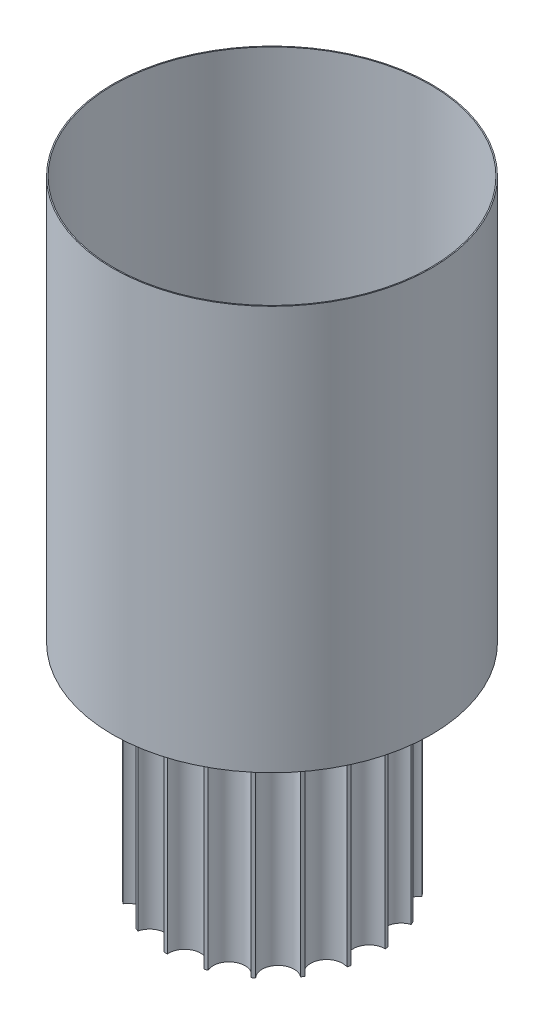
SolidWorks part; units mm, degrees
ref_plane "Alzado" through (0, 0, 0) normal (0, 0, 1) x (1, 0, 0)
ref_plane "Planta" through (0, 0, 0) normal (0, 1, 0) x (1, 0, 0)
ref_plane "Vista lateral" through (0, 0, 0) normal (1, 0, 0) x (0, 0, -1)
sketch "Croquis1" plane through (0, 0, 0) normal (0, 1, 0) x (1, 0, 0)
  circle A0 centre (0, 0) radius 100
  dimension "D1" = 200
extrude "Saliente-Extruir1" add sketch "Croquis1" along normal blind 200
sketch "Croquis2" plane through (0, 200, 0) normal (0, 1, 0) x (1, 0, 0)
  line L0 (0, 0) -> (0, 100) construction
  circle A0 centre (0, 0) radius 100 construction
  circle A1 centre (0, 100) radius 15
  circle A2 centre (32.4699, 94.5817) radius 15
  circle A3 centre (61.4213, 78.9141) radius 15
  circle A4 centre (83.7166, 54.6948) radius 15
  circle A5 centre (96.94, 24.5485) radius 15
  circle A6 centre (99.6584, -8.2579) radius 15
  circle A7 centre (91.5773, -40.1695) radius 15
  circle A8 centre (73.5724, -67.7282) radius 15
  circle A9 centre (47.5947, -87.9474) radius 15
  circle A10 centre (16.4595, -98.6361) radius 15
  circle A11 centre (-16.4595, -98.6361) radius 15
  circle A12 centre (-47.5947, -87.9474) radius 15
  circle A13 centre (-73.5724, -67.7282) radius 15
  circle A14 centre (-91.5773, -40.1695) radius 15
  circle A15 centre (-99.6584, -8.2579) radius 15
  circle A16 centre (-96.94, 24.5485) radius 15
  circle A17 centre (-83.7166, 54.6948) radius 15
  circle A18 centre (-61.4213, 78.9141) radius 15
  circle A19 centre (-32.4699, 94.5817) radius 15
  point P8 (-17.9574, 98.3745)
  point P9 (-14.9578, 98.875)
  point P45 (0, 0)
  dimension "D1" = 30
  dimension "D2" = 19
extrude "Cortar-Extruir1" cut sketch "Croquis2" against normal blind 200
sketch "Croquis5" plane through (0, 200, 0) normal (0, 1, 0) x (1, 0, 0)
  circle A0 centre (0, 0) radius 75
  dimension "D1" = 150
extrude "Cortar-Extruir2" cut sketch "Croquis5" against normal blind 180
sketch "Croquis6" plane through (0, 20, 0) normal (0, 1, 0) x (1, 0, 0)
  circle A0 centre (0, 0) radius 5
  dimension "D1" = 10
extrude "Cortar-Extruir3" cut sketch "Croquis6" against normal blind 180
fillet "Redondeo1" radius 2 1 edges at (0, 200, 75)
sketch "Croquis3" plane through (0, 0, 0) normal (0, -1, 0) x (1, 0, 0)
  circle A0 centre (0, 0) radius 80
  dimension "D1" = 160
extrude "Saliente-Extruir2" add sketch "Croquis3" along normal blind 3 separate body
sketch "Croquis4" plane through (0, 200, 0) normal (0, 1, 0) x (1, 0, 0)
  circle A0 centre (0, 0) radius 100
  dimension "D1" = 200
extrude "Saliente-Extruir3" add sketch "Croquis4" along normal blind 3 separate body
sketch "Croquis7" plane through (0, 203, 0) normal (0, 1, 0) x (1, 0, 0)
  circle A0 centre (0, 0) radius 10
  dimension "D1" = 20
extrude "Saliente-Extruir4" add sketch "Croquis7" along normal blind 0.01
sketch "Croquis8" plane through (0, 203.01, 0) normal (0, 1, 0) x (1, 0, 0)
  circle A0 centre (0, 0) radius 150
  circle A1 centre (0, 0) radius 149
  dimension "D1" = 300
  dimension "D2" = 298
extrude "Saliente-Extruir5" add sketch "Croquis8" along normal blind 380 separate body
sketch "Croquis9" plane through (0, -3, 0) normal (0, -1, 0) x (1, 0, 0)
  line L1 (-47.5, 47.5) -> (47.5, 47.5) construction
  line L2 (-47.5, 47.5) -> (-47.5, -47.5) construction
  line L3 (-47.5, -47.5) -> (47.5, -47.5) construction
  line L4 (47.5, 47.5) -> (47.5, -47.5) construction
  line L5 (-47.5, 47.5) -> (47.5, -47.5) construction
  line L6 (-47.5, -47.5) -> (47.5, 47.5) construction
  circle A2 centre (47.5, 47.5) radius 5
  circle A3 centre (-47.5, 47.5) radius 5
  circle A4 centre (-47.5, -47.5) radius 5
  circle A5 centre (47.5, -47.5) radius 5
  point P0 (0, 0)
  dimension "D3" = 10
  dimension "D4" = 10
  dimension "D5" = 10
  dimension "D6" = 10
  dimension "D1" = 95
  dimension "D2" = 95
extrude "Saliente-Extruir6" add sketch "Croquis9" along normal blind 3 separate body
